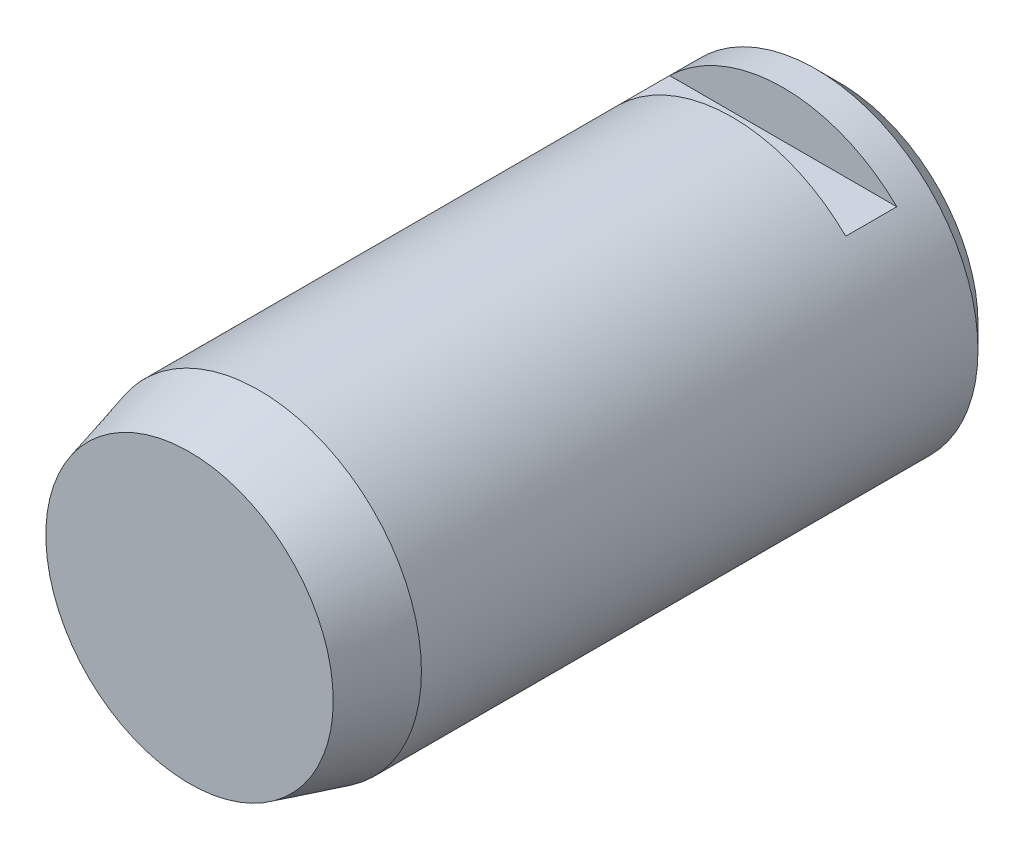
SolidWorks part; units mm, degrees
ref_plane "Plan de face" through (0, 0, 0) normal (0, 0, 1) x (1, 0, 0)
ref_plane "Plan de dessus" through (0, 0, 0) normal (0, 1, 0) x (1, 0, 0)
ref_plane "Plan de droite" through (0, 0, 0) normal (1, 0, 0) x (0, 0, -1)
sketch "Esquisse1" plane through (0, 0, 0) normal (0, 0, 1) x (1, 0, 0)
  circle A0 centre (0, 0) radius 35
  dimension "D1" = 70
extrude "Extrusion1" add sketch "Esquisse1" along normal blind 140
chamfer "Chanfrein1" distance 15 angle 15 1 edges at (35, 0, 140)
ref_plane "Plan1" through (0, 25, 0) normal (0, 1, 0) x (-1, 0, 0)
sketch "Esquisse2" plane through (0, 25, 0) normal (0, 1, 0) x (-1, 0, 0)
  line L0 (-35, 125) -> (-35, 0) construction
  line L1 (-35, 12) -> (35, 12)
  line L2 (-35, 12) -> (-35, 23)
  line L3 (-35, 23) -> (35, 23)
  line L4 (35, 12) -> (35, 23)
  line L5 (35, 0) -> (35, 125) construction
  line L8 (-35, 0) -> (35, 0) construction
  dimension "D1" = 23
  dimension "D2" = 11
extrude "Enlèv. mat.-Extru.1" cut sketch "Esquisse2" along normal up to next
chamfer "Chanfrein2" distance 5 angle 45 1 edges at (35, 0, 0)
